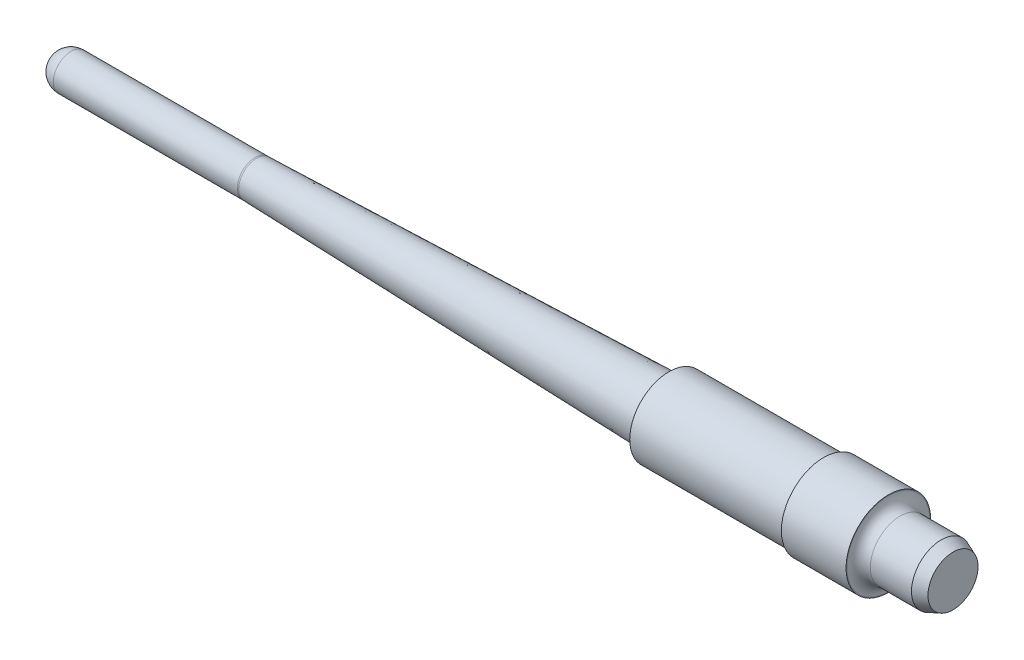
SolidWorks part; units mm, degrees
ref_plane "Front Plane" through (0, 0, 0) normal (0, 0, 1) x (1, 0, 0)
ref_plane "Top Plane" through (0, 0, 0) normal (0, 1, 0) x (1, 0, 0)
ref_plane "Right Plane" through (0, 0, 0) normal (1, 0, 0) x (0, 0, -1)
sketch "Sketch1" plane through (0, 0, 0) normal (0, 0, 1) x (1, 0, 0)
  line L0 (0, 0) -> (50000, 0) construction
  line L1 (0, 1.1557) -> (11.9253, 1.1557)
  line L2 (12.0186, 1.1571) -> (38.3779, 1.9322)
  line L3 (38.7477, 2.3131) -> (38.7477, 2.54)
  line L4 (38.7477, 2.54) -> (48.6664, 2.54)
  line L5 (48.7807, 2.6543) -> (48.7807, 2.7432)
  line L6 (48.7807, 2.7432) -> (52.9717, 2.7432)
  line L7 (52.9717, 2.7432) -> (52.9717, 2.6924)
  line L8 (53.7337, 1.9304) -> (56.4007, 1.9304)
  line L9 (57.1627, 1.6225) -> (57.1627, 0)
  line L10 (-1.1557, 0) -> (57.1627, 0)
  line L11 (56.4007, 1.9304) -> (57.1627, 1.6225)
  arc A0 (-1.1557, 0) -> (0, 1.1557) centre (0, 0) cw
  arc A1 (12.0186, 1.1571) -> (11.9253, 1.1557) centre (11.9253, 4.3307) cw
  arc A2 (38.7477, 2.3131) -> (38.3779, 1.9322) centre (38.3667, 2.3131) cw
  arc A3 (52.9717, 2.6924) -> (53.7337, 1.9304) centre (53.7337, 2.6924) ccw
  arc A4 (48.7807, 2.6543) -> (48.6664, 2.54) centre (48.6664, 2.6543) cw
  point P8 (57.1627, 1.9304)
  point P19 (38.7477, 1.9431)
  dimension "D1" = 1.1557
  dimension "D3" = 3.175
  dimension "D12" = 0.381
  dimension "D13" = 0.762
  dimension "D16" = 0.1143
  dimension "D2" = 13.081
  dimension "D4" = 3.8862
  dimension "D5" = 58.3184
  dimension "D6" = 5.08
  dimension "D7" = 4.191
  dimension "D8" = 14.224
  dimension "D9" = 4.191
  dimension "D10" = 3.8608
  dimension "D11" = 5.4864
  dimension "D14" = 0.762
  dimension "D15" = 22
revolve "Revolve1" add sketch "Sketch1" angle 360 about L0
